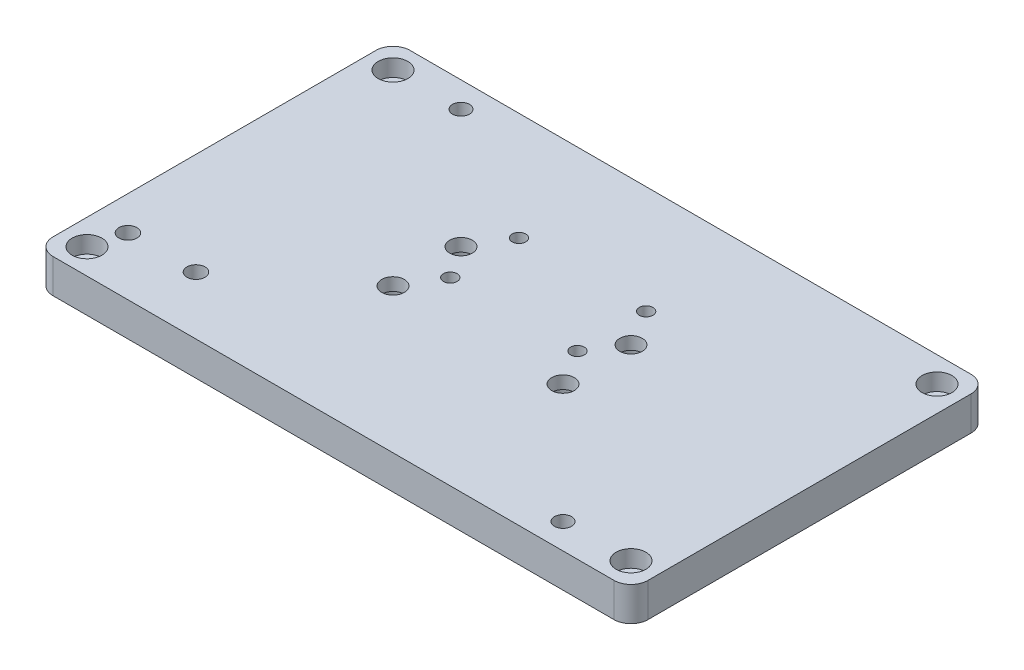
SolidWorks part; units mm, degrees
ref_plane "Front Plane" through (0, 0, 0) normal (0, 0, 1) x (1, 0, 0)
ref_plane "Top Plane" through (0, 0, 0) normal (0, 1, 0) x (1, 0, 0)
ref_plane "Right Plane" through (0, 0, 0) normal (1, 0, 0) x (0, 0, -1)
sketch "Sketch1" plane through (0, 0, 0) normal (0, 1, 0) x (1, 0, 0)
  line L1 (-111.125, 66.675) -> (111.125, 66.675)
  line L2 (-111.125, 66.675) -> (-111.125, -66.675)
  line L3 (-111.125, -66.675) -> (111.125, -66.675)
  line L4 (111.125, 66.675) -> (111.125, -66.675)
  line L5 (-111.125, 66.675) -> (111.125, -66.675) construction
  line L6 (-111.125, -66.675) -> (111.125, 66.675) construction
  point P0 (0, 0)
  dimension "D1" = 222.25
  dimension "D2" = 133.35
extrude "Boss-Extrude1" add sketch "Sketch1" along normal blind 12.7
hole_wizard "CBORE for 5/16 Socket Head Cap Screw1" positions "Sketch2" profile "Sketch3" counterbore size "5/16" standard "ANSI Inch"
sketch "Sketch2" plane through (0, 0, 0) normal (0, 1, 0) x (1, 0, 0)
  point P0 (31.75, 12.7)
  point P3 (-31.75, 12.7)
  point P6 (-31.75, -12.7)
  point P9 (31.75, -12.7)
sketch "Sketch3" plane through (31.75, 0, -12.7) normal (1, 0, 0) x (0, 0, -1)
  line L0 (0, 0) -> (0, 12.7)
  line L1 (0, 12.7) -> (4.2164, 12.7)
  line L3 (4.2164, 12.7) -> (4.2164, 7.9375)
  line L4 (4.2164, 7.9375) -> (6.7475, 7.9375)
  line L5 (6.7475, 7.9375) -> (6.7475, 0)
  line L7 (6.7475, 0) -> (0, 0)
  line L11 (0, -6.35) -> (0, 107.95) construction
  dimension "Thru Hole Dia." = 8.4328
  dimension "Thru Hole Depth" = 12.7
  dimension "C'Bore Dia." = 13.495
  dimension "C'Bore Depth" = 7.9375
hole_wizard "1/8-27 NPSM Tapped Hole1" positions "Sketch4" profile "Sketch5" tap size "1/8-27 NPSM" standard "ANSI Inch"
sketch "Sketch4" plane through (0, 12.7, 0) normal (0, 1, 0) x (1, 0, 0)
  line L0 (85.725, -47.625) -> (60.325, -47.625) construction
  line L1 (60.325, -47.625) -> (34.925, -47.625) construction
  line L2 (34.925, -47.625) -> (9.525, -47.625) construction
  line L5 (111.125, -66.675) -> (111.125, 66.675) construction
  line L6 (-111.125, -66.675) -> (111.125, -66.675) construction
  point P0 (85.725, -47.625)
  point P2 (60.325, -47.625)
  point P4 (34.925, -47.625)
  point P6 (9.525, -47.625)
  dimension "D1" = 25.4
  dimension "D2" = 19.05
  dimension "D3" = 25.4
sketch "Sketch5" plane through (85.725, 12.7, 47.625) normal (1, 0, 0) x (0, 0, 1)
  line L0 (0, 0) -> (0, 12.7)
  line L1 (0, 12.7) -> (4.5466, 12.7)
  line L2 (4.5466, 12.7) -> (4.5466, 0)
  line L5 (4.5466, 0) -> (0, 0)
  line L11 (0, -6.35) -> (0, 107.95) construction
  dimension "Thru Tap Drill Dia." = 9.0932
  dimension "Thru Tap Drill Depth" = 12.7
hole_wizard "CBORE for 1/4 Socket Head Cap Screw1" positions "Sketch6" profile "Sketch7" counterbore size "1/4" standard "ANSI Inch"
sketch "Sketch6" plane through (0, 12.7, 0) normal (0, 1, 0) x (1, 0, 0)
  line L0 (0, -66.675) -> (0, -73.2423) construction
  line L1 (-111.125, -66.675) -> (111.125, -66.675) construction
  line L3 (111.125, 0) -> (84.8659, 0) construction
  line L4 (111.125, -66.675) -> (111.125, 66.675) construction
  point P0 (101.6, -57.15)
  point P19 (101.6, 57.15)
  point P20 (-101.6, -57.15)
  point P21 (-101.6, 57.15)
sketch "Sketch7" plane through (101.6, 12.7, 57.15) normal (1, 0, 0) x (0, 0, 1)
  line L0 (0, 0) -> (0, 12.7)
  line L1 (0, 12.7) -> (3.3782, 12.7)
  line L3 (3.3782, 12.7) -> (3.3782, 6.35)
  line L4 (3.3782, 6.35) -> (5.5562, 6.35)
  line L5 (5.5562, 6.35) -> (5.5563, 0)
  line L7 (5.5563, 0) -> (0, 0)
  line L11 (0, -6.35) -> (0, 107.95) construction
  dimension "Thru Hole Dia." = 6.7564
  dimension "Thru Hole Depth" = 12.7
  dimension "C'Bore Dia." = 11.1125
  dimension "C'Bore Depth" = 6.35
hole_wizard "1/4 (0.2500) Dowel Hole1" positions "Sketch8" profile "Sketch9" hole size "1/4" standard "ANSI Inch"
sketch "Sketch8" plane through (0, 12.7, 0) normal (0, 1, 0) x (1, 0, 0)
  line L0 (101.6, -57.15) -> (76.2, -57.15) construction
  line L2 (-101.6, 57.15) -> (-76.2, 57.15) construction
  point P0 (76.2, -57.15)
  point P2 (-76.2, 57.15)
  dimension "D1" = 25.4
sketch "Sketch9" plane through (76.2, 12.7, 57.15) normal (1, 0, 0) x (0, 0, 1)
  line L0 (0, 0) -> (0, 12.7)
  line L1 (0, 12.7) -> (3.175, 12.7)
  line L2 (3.175, 12.7) -> (3.175, 0)
  line L5 (3.175, 0) -> (0, 0)
  line L11 (0, -6.35) -> (0, 107.95) construction
  dimension "Thru Hole Dia." = 6.35
  dimension "Thru Hole Depth" = 12.7
hole_wizard "CBORE for #10 Socket Head Cap Screw1" positions "Sketch12" profile "Sketch13" counterbore size "#10" standard "ANSI Inch"
sketch "Sketch12" plane through (0, 0, 0) normal (0, -1, 0) x (-1, 0, 0)
  point P0 (-23.749, 26.3477)
  point P3 (-23.749, 0.6937)
  point P6 (23.749, 26.3477)
  point P9 (23.749, 0.6937)
sketch "Sketch13" plane through (23.749, 0, -26.3477) normal (1, 0, 0) x (0, 0, -1)
  line L0 (0, 0) -> (0, 12.7)
  line L1 (0, 12.7) -> (2.5527, 12.7)
  line L3 (2.5527, 12.7) -> (2.5527, 4.826)
  line L4 (2.5527, 4.826) -> (4.7625, 4.826)
  line L5 (4.7625, 4.826) -> (4.7625, 0)
  line L7 (4.7625, 0) -> (0, 0)
  line L11 (0, -6.35) -> (0, 107.95) construction
  dimension "Thru Hole Dia." = 5.1054
  dimension "Thru Hole Depth" = 12.7
  dimension "C'Bore Dia." = 9.525
  dimension "C'Bore Depth" = 4.826
hole_wizard "CBORE for 1/4 Socket Head Cap Screw3" positions "Sketch14" profile "Sketch15" counterbore size "1/4" standard "ANSI Inch"
sketch "Sketch14" plane through (0, 0, 0) normal (0, -1, 0) x (-1, 0, 0)
  point P0 (73.025, -45.025)
  point P3 (98.425, -45.025)
sketch "Sketch15" plane through (-73.025, 0, 45.025) normal (1, 0, 0) x (0, 0, -1)
  line L0 (0, 0) -> (0, 12.7)
  line L1 (0, 12.7) -> (3.3782, 12.7)
  line L3 (3.3782, 12.7) -> (3.3782, 6.35)
  line L4 (3.3782, 6.35) -> (5.5562, 6.35)
  line L5 (5.5562, 6.35) -> (5.5563, 0)
  line L7 (5.5563, 0) -> (0, 0)
  line L11 (0, -6.35) -> (0, 107.95) construction
  dimension "Thru Hole Dia." = 6.7564
  dimension "Thru Hole Depth" = 12.7
  dimension "C'Bore Dia." = 11.1125
  dimension "C'Bore Depth" = 6.35
fillet "Fillet1" radius 6.35 4 edges at (111.125, 6.35, -66.675) (111.125, 6.35, 66.675) (-111.125, 6.35, -66.675) (-111.125, 6.35, 66.675)
equation "\"D2@Sketch6\"=\"D1@Sketch6\""
